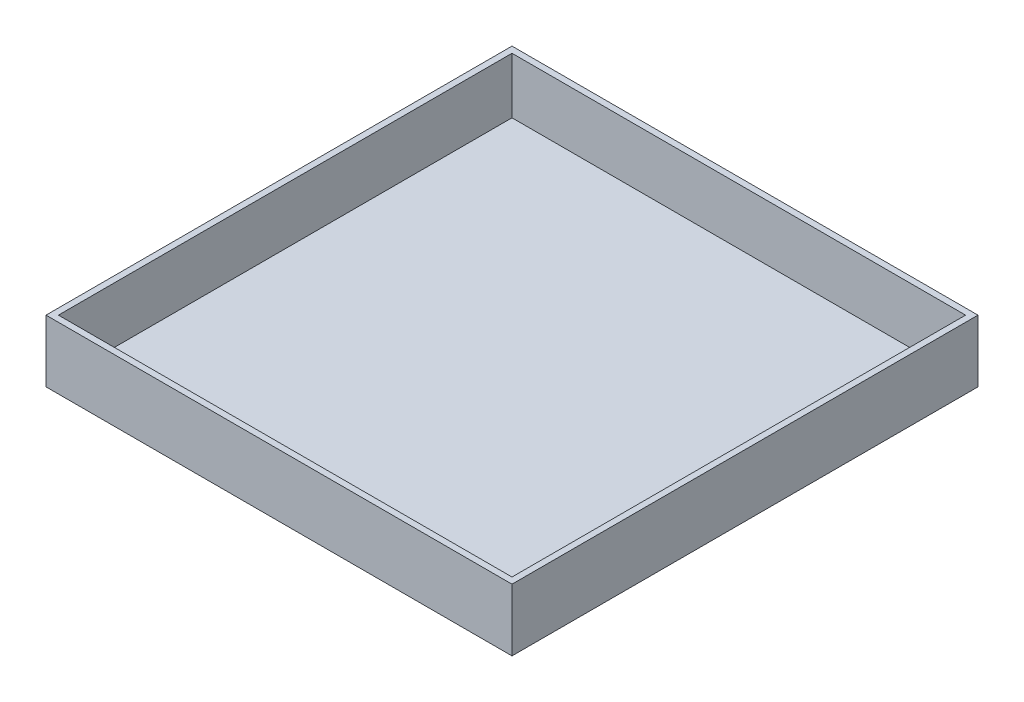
SolidWorks part; units mm, degrees
ref_plane "Front" through (0, 0, 0) normal (0, 0, 1) x (1, 0, 0)
ref_plane "Top" through (0, 0, 0) normal (0, 1, 0) x (1, 0, 0)
ref_plane "Right" through (0, 0, 0) normal (1, 0, 0) x (0, 0, -1)
sketch "Sketch1" plane through (0, 0, 0) normal (0, 1, 0) x (1, 0, 0)
  line L0 (75, -75) -> (-75, 75) construction
  line L1 (-75, 75) -> (75, 75)
  line L2 (-75, 75) -> (-75, -75)
  line L3 (-75, -75) -> (75, -75)
  line L4 (75, 75) -> (75, -75)
  dimension "D1" = 150
  dimension "D2" = 150
extrude "Extrude1" add sketch "Sketch1" along normal blind 20
shell "Shell1" thickness 2
ref_plane "Plane1" through (0, 15, 0) normal (0, 1, 0) x (-1, 0, 0)
sketch "Sketch2" plane through (0, 15, 0) normal (0, 1, 0) x (-1, 0, 0)
  line L0 (66.5466, -51.3086) -> (-61.999, -51.3086)
  line L1 (66.5466, -40.4546) -> (-61.999, -40.4546)
  line L2 (66.5466, -26.9548) -> (-62.0118, -26.9548)
  line L3 (55.9355, -66.5466) -> (55.9355, 54.1165)
  line L4 (45.9308, -66.5466) -> (45.9308, 54.1165)
  line L5 (25.1787, -17.8825) -> (25.1787, 47.7874)
  line L8 (66.5466, 26.9548) -> (-62.0118, 26.9548)
  line L9 (66.5466, 40.4546) -> (-61.999, 40.4546)
  line L10 (66.5466, 51.3086) -> (-61.999, 51.3086)
  line L11 (-25.1787, -17.8825) -> (-25.1787, 47.7874)
  line L12 (-45.9308, -66.5466) -> (-45.9308, 54.1165)
  line L13 (-55.9355, -66.5466) -> (-55.9355, 54.1165)
